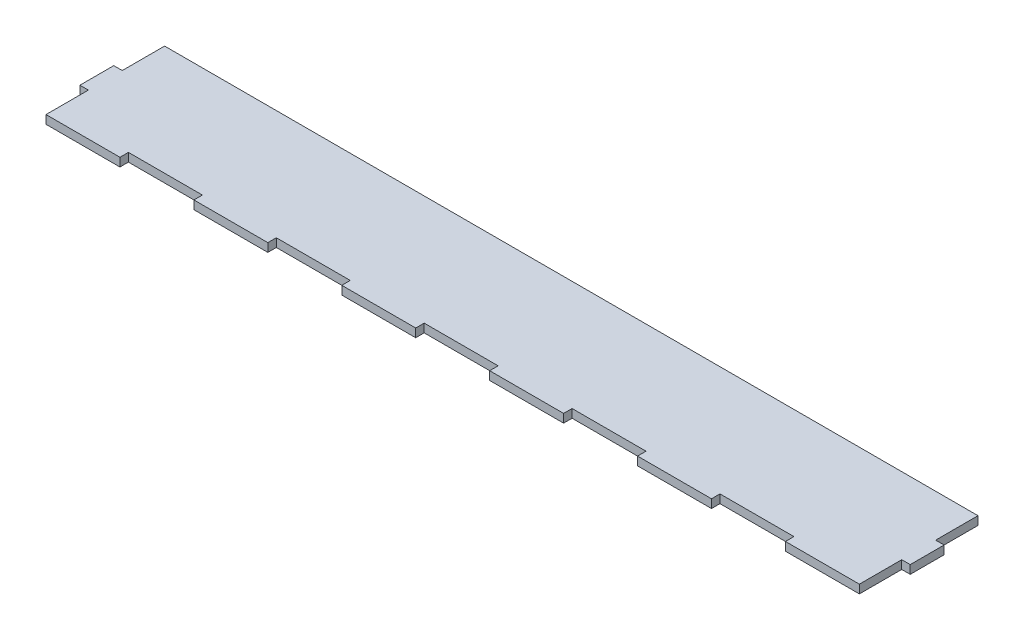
SolidWorks part; units mm, degrees
ref_plane "Front Plane" through (0, 0, 0) normal (0, 0, 1) x (1, 0, 0)
ref_plane "Top Plane" through (0, 0, 0) normal (0, 1, 0) x (1, 0, 0)
ref_plane "Right Plane" through (0, 0, 0) normal (1, 0, 0) x (0, 0, -1)
sketch "Sketch1" plane through (0, 0, 0) normal (0, 1, 0) x (1, 0, 0)
  line L0 (-152.4, 41.275) -> (-152.4, 25.4)
  line L1 (-152.4, 25.4) -> (-155.575, 25.4)
  line L2 (-155.575, 25.4) -> (-155.575, 12.7)
  line L3 (-155.575, 12.7) -> (-152.4, 12.7)
  line L4 (-152.4, 12.7) -> (-152.4, -3.175)
  line L5 (-152.4, -3.175) -> (-124.6909, -3.175)
  line L6 (-124.6909, -3.175) -> (-124.6909, 0)
  line L7 (-124.6909, 0) -> (-96.9818, 0)
  line L8 (-96.9818, 0) -> (-96.9818, -3.175)
  line L9 (-96.9818, -3.175) -> (-69.2727, -3.175)
  line L10 (-69.2727, -3.175) -> (-69.2727, 0)
  line L11 (-69.2727, 0) -> (-41.5636, 0)
  line L12 (-41.5636, 0) -> (-41.5636, -3.175)
  line L13 (-41.5636, -3.175) -> (-13.8545, -3.175)
  line L14 (-13.8545, -3.175) -> (-13.8545, 0)
  line L15 (-13.8545, 0) -> (13.8545, 0)
  line L16 (13.8545, 0) -> (13.8545, -3.175)
  line L17 (13.8545, -3.175) -> (41.5636, -3.175)
  line L18 (41.5636, -3.175) -> (41.5636, 0)
  line L19 (41.5636, 0) -> (69.2727, 0)
  line L20 (69.2727, 0) -> (69.2727, -3.175)
  line L21 (69.2727, -3.175) -> (96.9818, -3.175)
  line L22 (96.9818, -3.175) -> (96.9818, 0)
  line L23 (96.9818, 0) -> (124.6909, 0)
  line L24 (124.6909, 0) -> (124.6909, -3.175)
  line L25 (124.6909, -3.175) -> (152.4, -3.175)
  line L26 (152.4, -3.175) -> (152.4, 12.7)
  line L27 (152.4, 12.7) -> (155.575, 12.7)
  line L28 (155.575, 12.7) -> (155.575, 25.4)
  line L29 (155.575, 25.4) -> (152.4, 25.4)
  line L30 (152.4, 25.4) -> (152.4, 41.275)
  line L31 (152.4, 41.275) -> (-152.4, 41.275)
  line L32 (-44.5782, 38.1) -> (-30.8633, 38.1) construction
  line L33 (0, 0) -> (0, 12.7) construction
  line L34 (0, 12.7) -> (0, 25.4) construction
  line L35 (0, 25.4) -> (0, 38.1) construction
extrude "Boss-Extrude1" add sketch "Sketch1" along normal blind 3.175
equation "\"innerWidth\"= 12in"
equation "\"innerDepth\" = 1in"
equation "\"innerHeight\"= 1.5in"
equation "\"matThickness\"= .125in"
equation "\"latchWidth\"=20mm"
equation "\"D1@Sketch1\"=\"matThickness\""
equation "\"D2@Sketch1\"=\"matThickness\""
equation "\"D3@Sketch1\"=\"innerHeight\""
equation "\"D1@Boss-Extrude1\"=\"matThickness\""
